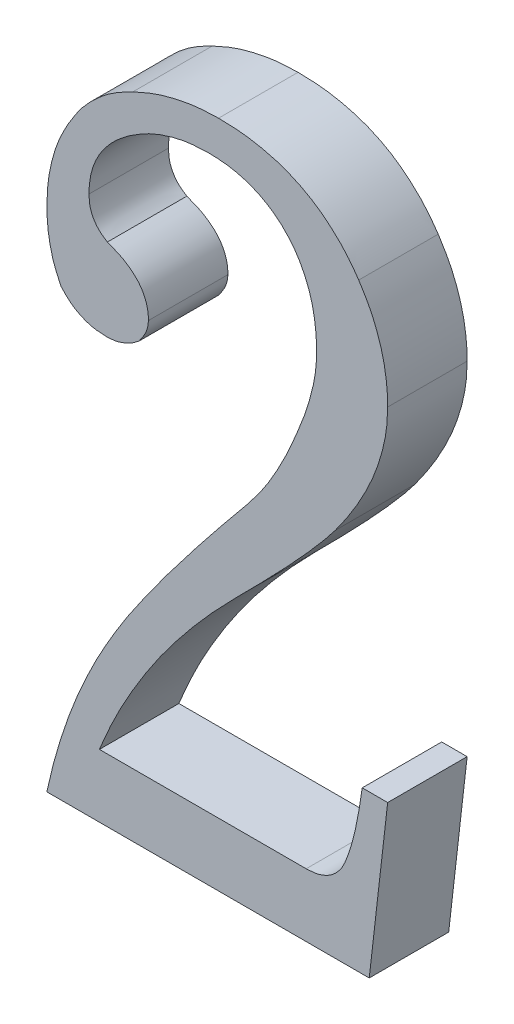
SolidWorks part; units mm, degrees
ref_plane "前基準面" through (0, 0, 0) normal (0, 0, 1) x (1, 0, 0)
ref_plane "上基準面" through (0, 0, 0) normal (0, 1, 0) x (1, 0, 0)
ref_plane "右基準面" through (0, 0, 0) normal (1, 0, 0) x (0, 0, -1)
sketch "草圖1" plane through (0, 0, 0) normal (0, 0, 1) x (1, 0, 0)
  text T0 "2" font "標楷體" height 25
extrude "填料-伸長1" add sketch "草圖1" along normal blind 3
